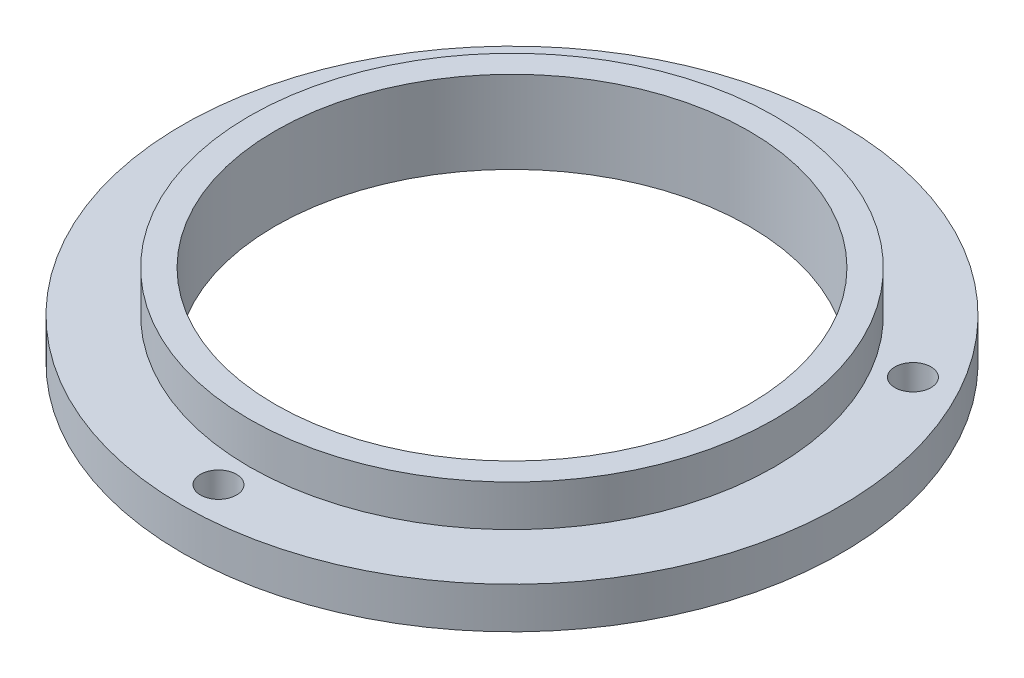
SolidWorks part; units mm, degrees
ref_plane "Piano frontale" through (0, 0, 0) normal (0, 0, 1) x (1, 0, 0)
ref_plane "Piano superiore" through (0, 0, 0) normal (0, 1, 0) x (1, 0, 0)
ref_plane "Piano destro" through (0, 0, 0) normal (1, 0, 0) x (0, 0, -1)
sketch "Schizzo1" plane through (0, 0, 0) normal (0, 0, 1) x (1, 0, 0)
  line L0 (0, 65.1723) -> (0, -77.4607) construction
  line L1 (23, -4) -> (32, -4)
  line L2 (32, -4) -> (32, 0)
  line L3 (32, 0) -> (25.5, 0)
  line L4 (25.5, 0) -> (25.5, 4)
  line L5 (25.5, 4) -> (23, 4)
  line L6 (23, 4) -> (23, -4)
  dimension "D1" = 23
  dimension "D2" = 32
  dimension "D3" = 2.5
  dimension "D4" = 4
  dimension "D5" = 8
revolve "Rivoluzione1" add sketch "Schizzo1" angle 360 about L0
sketch "Schizzo3" plane through (0, -4, 0) normal (0, -1, 0) x (-1, 0, 0)
  circle A0 centre (0, -28.5) radius 1.75
  circle A1 centre (-24.6817, 14.25) radius 1.75
  circle A2 centre (24.6817, 14.25) radius 1.75
  point P10 (0, 0)
  dimension "D1" = 28.5
  dimension "D3" = 3.5
  dimension "D2" = 3
extrude "Taglio-Estrusione2" cut sketch "Schizzo3" against normal through all
